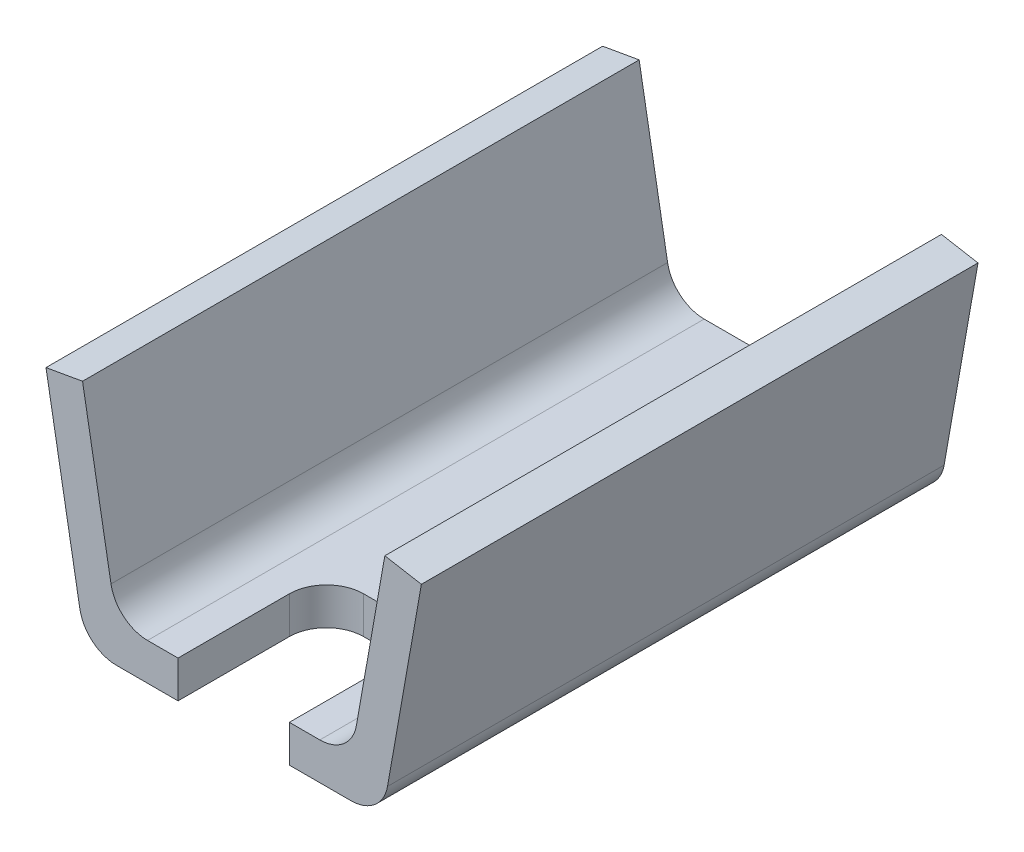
SolidWorks part; units mm, degrees
ref_plane "前视基准面" through (0, 0, 0) normal (0, 0, 1) x (1, 0, 0)
ref_plane "上视基准面" through (0, 0, 0) normal (0, 1, 0) x (1, 0, 0)
ref_plane "右视基准面" through (0, 0, 0) normal (1, 0, 0) x (0, 0, -1)
sketch "草图1" plane through (0, 0, 0) normal (0, 0, 1) x (1, 0, 0)
  line L0 (-15.8045, 0) -> (15.8045, 0)
  line L1 (20.7285, 4.1318) -> (25.2898, 30)
  line L2 (25.2898, 30) -> (20.3658, 30.8682)
  line L3 (20.3658, 30.8682) -> (16.533, 9.1318)
  line L4 (11.609, 5) -> (-11.609, 5)
  line L5 (-16.533, 9.1318) -> (-20.3658, 30.8682)
  line L6 (-20.7285, 4.1318) -> (-25.2898, 30)
  line L7 (-25.2898, 30) -> (-20.3658, 30.8682)
  arc A0 (-11.609, 5) -> (-16.533, 9.1318) centre (-11.609, 10) cw
  arc A1 (11.609, 5) -> (16.533, 9.1318) centre (11.609, 10) ccw
  arc A2 (15.8045, 0) -> (20.7285, 4.1318) centre (15.8045, 5) ccw
  arc A3 (-15.8045, 0) -> (-20.7285, 4.1318) centre (-15.8045, 5) cw
  point P15 (20, 0)
  point P18 (-20, 0)
  dimension "D10" = 5
  dimension "D1" = 5
  dimension "D2" = 5
  dimension "D3" = 5
  dimension "D4" = 40
  dimension "D5" = 20
  dimension "D6" = 100
  dimension "D7" = 100
  dimension "D8" = 30
  dimension "D9" = 30
extrude "拉伸1" add sketch "草图1" along normal blind 75
sketch "草图2" plane through (0, 0, 0) normal (0, -1, 0) x (1, 0, 0)
  line L0 (0, 81.8258) -> (0, 0) construction
  line L1 (-7.5, 75) -> (7.5, 75)
  line L2 (-15.8045, 75) -> (15.8045, 75) construction
  line L3 (7.5, 75) -> (7.5, 60)
  line L4 (2.5, 55) -> (-2.5, 55)
  line L5 (-7.5, 60) -> (-7.5, 75)
  arc A0 (-2.5, 55) -> (-7.5, 60) centre (-2.5, 60) cw
  arc A1 (7.5, 60) -> (2.5, 55) centre (2.5, 60) cw
  point P11 (-7.5, 55)
  point P14 (7.5, 55)
  dimension "D4" = 5
  dimension "D1" = 15
  dimension "D2" = 20
  dimension "D3" = 7.5
extrude "切除-拉伸1" cut sketch "草图2" against normal through all
